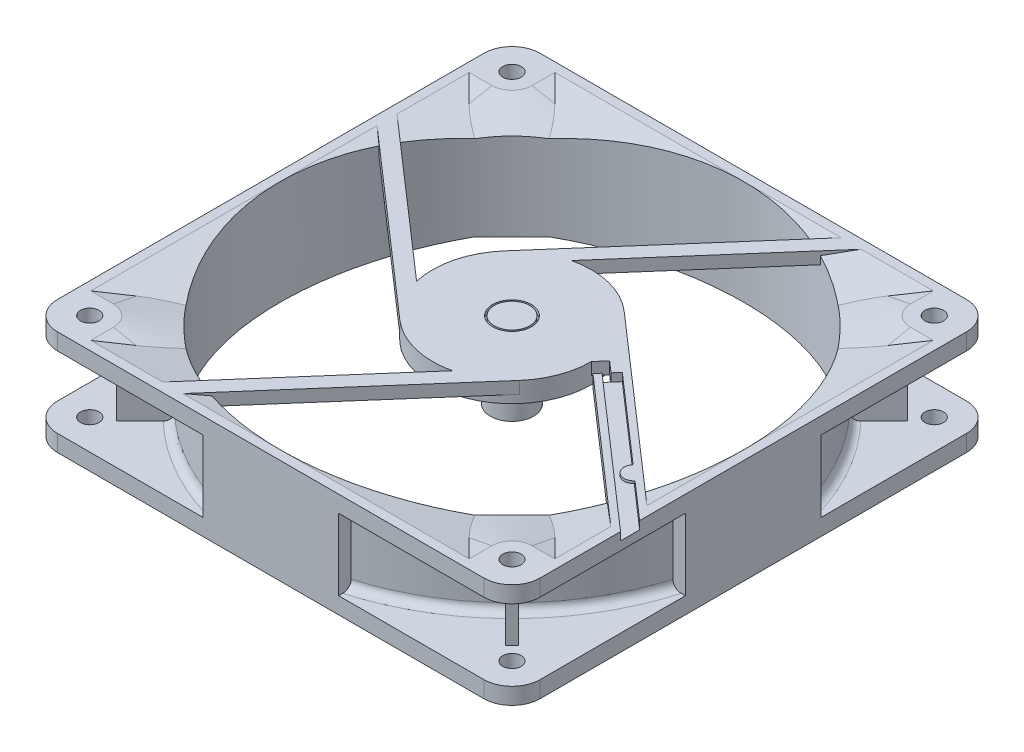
SolidWorks part; units mm, degrees
ref_plane "Front Plane" through (0, 0, 0) normal (0, 0, 1) x (1, 0, 0)
ref_plane "Top Plane" through (0, 0, 0) normal (0, 1, 0) x (1, 0, 0)
ref_plane "Right Plane" through (0, 0, 0) normal (1, 0, 0) x (0, 0, -1)
sketch "Sketch1" plane through (0, 0, 0) normal (0, 1, 0) x (1, 0, 0)
  line L1 (-60, 60) -> (60, 60)
  line L2 (-60, 60) -> (-60, -60)
  line L3 (-60, -60) -> (60, -60)
  line L4 (60, 60) -> (60, -60)
  line L5 (-60, 60) -> (-52.5, 52.5) construction
  line L6 (-60, -60) -> (-52.5, -52.5) construction
  line L7 (52.5, 52.5) -> (60, 60) construction
  line L8 (52.5, -52.5) -> (60, -60) construction
  line L10 (-50.8737, -50.8737) -> (50.8737, 50.8737) construction
  line L11 (-50.8737, 50.8737) -> (50.8737, -50.8737) construction
  line L12 (-50.8737, -50.8737) -> (50.8737, 50.8737) construction
  line L16 (-50.8737, 50.8737) -> (50.8737, -50.8737) construction
  circle A0 centre (-52.5, 52.5) radius 2.3
  circle A1 centre (52.5, 52.5) radius 2.3
  circle A2 centre (52.5, -52.5) radius 2.3
  circle A3 centre (-52.5, -52.5) radius 2.3
  point P0 (0, 0)
  point P6 (0, 0)
  dimension "D5" = 4.6
  dimension "D1" = 120
  dimension "D2" = 120
  dimension "D3" = 105
  dimension "D4" = 105
extrude "Boss-Extrude1" add sketch "Sketch1" along normal blind 26
sketch "Sketch2" plane through (0, 26, 0) normal (0, 1, 0) x (1, 0, 0)
  circle A0 centre (0, 0) radius 57.7
extrude "Cut-Extrude1" cut sketch "Sketch2" against normal blind 30
sketch "Sketch4" plane through (0, 0, 0) normal (1, 0, 0) x (0, 0, -1)
  line L0 (0, 0) -> (0, 42.0699) construction
  line L1 (-59.3503, 19.877) -> (-59.3503, 6.123)
  line L2 (-61.3503, 21.877) -> (-105.7428, 21.877)
  line L3 (-105.7428, 21.877) -> (-105.7428, 4.123)
  line L5 (-61.3503, 4.123) -> (-105.7428, 4.123)
  arc A0 (-59.3503, 6.123) -> (-61.3503, 4.123) centre (-61.3503, 6.123) cw
  arc A1 (-59.3503, 19.877) -> (-61.3503, 21.877) centre (-61.3503, 19.877) ccw
  point P11 (-52.0048, 13)
  point P14 (-105.7428, 13)
  dimension "D1" = 2
revolve "Cut-Revolve2" cut sketch "Sketch4" angle 360 about L0
sketch "Sketch5" plane through (0, 0, 0) normal (1, 0, 0) x (0, 0, -1)
  line L0 (-60, 0) -> (60, 0) construction
  line L1 (-16.8871, 26) -> (16.8871, 26)
  line L2 (-16.8871, 26) -> (-16.8871, 0)
  line L3 (-16.8871, 0) -> (16.8871, 0)
  line L4 (16.8871, 26) -> (16.8871, 0)
  line L5 (-16.8871, 26) -> (16.8871, 0) construction
  line L6 (-16.8871, 0) -> (16.8871, 26) construction
  point P0 (0, 13)
  dimension "D1" = 33.7741
extrude "Boss-Extrude2" add sketch "Sketch5" along normal up to surface and the other way up to surface
sketch "Sketch6" plane through (0, 0, 0) normal (0, 0, 1) x (1, 0, 0)
  line L0 (60, 26) -> (-60, 26) construction
  line L1 (16.894, 0) -> (-16.894, 0)
  line L2 (16.894, 0) -> (16.894, 26)
  line L3 (16.894, 26) -> (-16.894, 26)
  line L4 (-16.894, 0) -> (-16.894, 26)
  line L5 (16.894, 0) -> (-16.894, 26) construction
  line L6 (16.894, 26) -> (-16.894, 0) construction
  point P0 (0, 13)
extrude "Boss-Extrude3" add sketch "Sketch6" along normal up to surface and the other way up to surface
sketch "Sketch7" plane through (0, 26, 0) normal (0, 1, 0) x (1, 0, 0)
  circle A0 centre (0, 0) radius 57.7
extrude "Cut-Extrude2" cut sketch "Sketch7" against normal blind 50
fillet "Fillet1" radius 7 8 edges at (-60, 2.0615, 60) (-60, 23.9385, 60) (60, 23.9385, 60) (60, 2.0615, 60) (-60, 2.0615, -60) (-60, 23.9385, -60) (60, 2.0615, -60) (60, 23.9385, -60)
sketch "Sketch8" plane through (0, 26, 0) normal (0, 1, 0) x (1, 0, 0)
  line L0 (52.5, 52.5) -> (40.2381, 40.2381) construction
  line L1 (48.364, 50.0322) -> (50.0322, 48.364)
  line L2 (50.0322, 48.364) -> (41.0722, 39.404)
  line L3 (48.364, 50.0322) -> (39.404, 41.0722)
  line L4 (50.0322, -48.364) -> (41.0722, -39.404)
  line L5 (48.364, -50.0322) -> (39.404, -41.0722)
  line L6 (50.0322, -48.364) -> (48.364, -50.0322)
  line L7 (-48.364, -50.0322) -> (-39.404, -41.0722)
  line L8 (-50.0322, -48.364) -> (-41.0722, -39.404)
  line L9 (-48.364, -50.0322) -> (-50.0322, -48.364)
  line L10 (-50.0322, 48.364) -> (-41.0722, 39.404)
  line L11 (-48.364, 50.0322) -> (-39.404, 41.0722)
  line L12 (-50.0322, 48.364) -> (-48.364, 50.0322)
  line L13 (-39.404, 41.0722) -> (-41.0722, 39.404)
  line L14 (39.404, 41.0722) -> (41.0722, 39.404)
  line L15 (41.0722, -39.404) -> (39.404, -41.0722)
  line L16 (-41.0722, -39.404) -> (-39.404, -41.0722)
  point P7 (49.1981, 49.1981)
  point P23 (0, 0)
  dimension "D1" = 4
extrude "Boss-Extrude4" add sketch "Sketch8" against normal up to surface (26 mm away)
sketch "Sketch9" plane through (0, 26, 0) normal (0, 1, 0) x (1, 0, 0)
  circle A0 centre (0, 0) radius 57.7
extrude "Cut-Extrude3" cut sketch "Sketch9" against normal blind 50
ref_plane "Plane1" through (0, 13, 0) normal (0, 1, 0) x (1, 0, 0)
sketch "Sketch10" plane through (0, 26, 0) normal (0, 1, 0) x (1, 0, 0)
  line L1 (-52.0503, 47.0503) -> (-57.7041, 47.0503)
  line L2 (-47.0503, 52.0503) -> (-47.0503, 57.7041)
  line L6 (-47.0503, -57.7041) -> (47.0503, -57.7041)
  line L7 (-57.7041, -47.0503) -> (-57.7041, 47.0503)
  line L8 (-47.0503, 57.7041) -> (47.0503, 57.7041)
  line L9 (57.7041, -47.0503) -> (57.7041, 47.0503)
  line L10 (-48.5147, -48.5147) -> (57.7041, 57.7041) construction
  line L11 (47.0503, -47.0503) -> (-47.0503, 47.0503) construction
  line L12 (47.0503, 47.0503) -> (-47.0503, -47.0503) construction
  line L14 (52.0503, 47.0503) -> (57.7041, 47.0503)
  line L15 (47.0503, 52.0503) -> (47.0503, 57.7041)
  line L18 (47.0503, -52.0503) -> (47.0503, -57.7041)
  line L19 (52.0503, -47.0503) -> (57.7041, -47.0503)
  line L22 (-52.0503, -47.0503) -> (-57.7041, -47.0503)
  line L23 (-47.0503, -52.0503) -> (-47.0503, -57.7041)
  line L24 (-48.5147, 48.5147) -> (48.5147, -48.5147) construction
  arc A1 (47.0503, -52.0503) -> (52.0503, -47.0503) centre (52.0503, -52.0503) cw
  arc A2 (52.0503, 47.0503) -> (47.0503, 52.0503) centre (52.0503, 52.0503) cw
  arc A3 (-52.0503, 47.0503) -> (-47.0503, 52.0503) centre (-52.0503, 52.0503) ccw
  arc A4 (-52.0503, -47.0503) -> (-47.0503, -52.0503) centre (-52.0503, -52.0503) cw
  point P0 (-52.5, 52.5)
  point P9 (0, 0)
  point P32 (0, 0)
  point P36 (0, 0)
  dimension "D2" = 5
  dimension "D1" = 4
extrude "Cut-Extrude4" cut sketch "Sketch10" against normal blind 3 draft 79
mirror "Mirror1" about plane through (0, 13, 0) normal (0, 1, 0) of "Cut-Extrude4"
sketch "Sketch11" plane through (0, 26, 0) normal (0, 1, 0) x (1, 0, 0)
  circle A0 centre (0, 0) radius 19.77
extrude "Boss-Extrude5" add sketch "Sketch11" against normal blind 5 separate body
sketch "Sketch12" plane through (0, 26, 0) normal (0, 1, 0) x (1, 0, 0)
  line L0 (24.1445, 57.7041) -> (-14.8911, 13.0041) construction
  line L1 (47.0503, 57.7041) -> (-47.0503, 57.7041) construction
  line L2 (-14.8911, 13.0041) -> (-12.0764, 10.5461) construction
  line L3 (-14.8911, 13.0041) -> (24.1445, 57.7041)
  line L4 (24.1445, 57.7041) -> (29.1057, 57.7041)
  line L5 (29.1057, 57.7041) -> (-12.0764, 10.5461)
  line L6 (-14.8911, 13.0041) -> (-12.0764, 10.5461)
  line L7 (13.0041, 14.8911) -> (57.7041, -24.1445)
  line L8 (57.7041, -29.1057) -> (10.5461, 12.0764)
  line L9 (57.7041, -24.1445) -> (57.7041, -29.1057)
  line L10 (13.0041, 14.8911) -> (10.5461, 12.0764)
  line L11 (14.8911, -13.0041) -> (-24.1445, -57.7041)
  line L12 (-29.1057, -57.7041) -> (12.0764, -10.5461)
  line L13 (-24.1445, -57.7041) -> (-29.1057, -57.7041)
  line L14 (14.8911, -13.0041) -> (12.0764, -10.5461)
  line L15 (-13.0041, -14.8911) -> (-57.7041, 24.1445)
  line L16 (-57.7041, 29.1057) -> (-10.5461, -12.0764)
  line L17 (-57.7041, 24.1445) -> (-57.7041, 29.1057)
  line L18 (-13.0041, -14.8911) -> (-10.5461, -12.0764)
  circle A0 centre (0, 0) radius 19.77 construction
  point P23 (0, 0)
  dimension "D1" = 4
extrude "Boss-Extrude6" add sketch "Sketch12" against normal blind 3
sketch "Sketch13" plane through (0, 26, 0) normal (0, 1, 0) x (1, 0, 0)
  circle A0 centre (0, 0) radius 4.3649
extrude "Cut-Extrude5" cut sketch "Sketch13" against normal blind 10
sketch "Sketch14" plane through (0, 26, 0) normal (0, 1, 0) x (1, 0, 0)
  circle A0 centre (0, 0) radius 4.3649
extrude "Extrude-Thin1" add sketch "Sketch14" against normal blind 19 thin
sketch "Sketch15" plane through (0, 7, 0) normal (0, -1, 0) x (1, 0, 0)
  circle A0 centre (0, 0) radius 4.3649
extrude "Boss-Extrude7" add sketch "Sketch15" against normal blind 14
sketch "Sketch16" plane through (0, 21, 0) normal (0, 1, 0) x (1, 0, 0)
  circle A0 centre (0, 0) radius 1.4328
  dimension "D1" = 2.8657
extrude "Cut-Extrude6" cut sketch "Sketch16" against normal blind 34
sketch "Sketch17" plane through (0, 26, 0) normal (0, 1, 0) x (1, 0, 0)
  line L0 (19.77, 0) -> (57.7041, -33.1271)
  line L1 (57.7041, -47.0503) -> (57.7041, -29.1057) construction
  line L2 (57.7041, -24.1445) -> (13.0041, 14.8911) construction
  line L9 (14.8911, -13.0041) -> (-24.1445, -57.7041)
  line L10 (57.7041, -29.1057) -> (19.2585, 4.4681)
  line L11 (57.7041, -47.0503) -> (57.7041, -29.1057)
  line L12 (52.0503, -47.0503) -> (57.7041, -47.0503)
  line L13 (47.0503, -57.7041) -> (47.0503, -52.0503)
  line L14 (-24.1445, -57.7041) -> (47.0503, -57.7041)
  line L16 (57.7041, -29.1057) -> (19.2585, 4.4681)
  line L17 (57.7041, -33.1271) -> (57.7041, -29.1057)
  arc A0 (14.8911, -13.0041) -> (19.2585, 4.4681) centre (0, 0) ccw construction
  arc A3 (14.8911, -13.0041) -> (19.2585, 4.4681) centre (0, 0) ccw
  arc A4 (52.0503, -47.0503) -> (47.0503, -52.0503) centre (52.0503, -52.0503) ccw
  arc A5 (19.77, 0) -> (19.2585, 4.4681) centre (0, 0) ccw
  dimension "D1" = 0
extrude "Boss-Extrude8" add sketch "Sketch17" against normal up to surface (3 mm away)
sketch "Sketch18" plane through (0, 26, 0) normal (0, 1, 0) x (1, 0, 0)
  line L0 (19.77, 0) -> (21.8739, 2.4092)
  line L1 (21.8739, 2.4092) -> (24.6327, 0)
  line L2 (24.6327, 0) -> (21.332, -3.7797)
  line L3 (21.332, -3.7797) -> (19.77, 0)
extrude "Cut-Extrude7" cut sketch "Sketch18" against normal blind 3
sketch "Sketch19" plane through (0, 26, 0) normal (0, 1, 0) x (1, 0, 0)
  line L0 (23.5807, -1.2046) -> (61.5209, -34.337)
  line L1 (22.5288, -2.4092) -> (24.6327, 0) construction
  line L2 (61.5209, -34.337) -> (61.5209, -29.5833)
  line L3 (61.5209, -29.5833) -> (25.936, 1.4924)
  line L4 (25.936, 1.4924) -> (23.5807, -1.2046)
extrude "Cut-Extrude8" cut sketch "Sketch19" against normal blind 2 contours L3 L4 L0 L2
sketch "Sketch20" plane through (0, 26, 0) normal (0, 1, 0) x (1, 0, 0)
  line L0 (60, -28.255) -> (25.936, 1.4924) construction
  line L1 (60, -28.255) -> (25.936, 1.4924) construction
  line L2 (47.1637, -17.0454) -> (50.8722, -20.2839)
  line L3 (50.8722, -20.2839) -> (50.8014, -20.1933)
  arc A0 (47.1637, -17.0454) -> (50.8722, -20.2839) centre (49.018, -18.6646) ccw
extrude "Boss-Extrude9" add sketch "Sketch20" against normal blind 0.6 contours L2 A0
sketch "Sketch21" plane through (0, 21, 0) normal (0, 1, 0) x (1, 0, 0)
  circle A0 centre (0, 0) radius 4.3649
extrude "Cut-Extrude9" cut sketch "Sketch21" against normal blind 3
sketch "Sketch22" plane through (0, 26, 0) normal (0, 1, 0) x (1, 0, 0)
  circle A0 centre (0, 0) radius 4.3649
extrude "Boss-Extrude10" add sketch "Sketch22" against normal blind 1 separate body
sketch "Sketch23" plane through (0, 26, 0) normal (0, 1, 0) x (1, 0, 0)
  circle A0 centre (0, 0) radius 4.8169
extrude "Cut-Extrude-Thin1" cut sketch "Sketch23" against normal blind 1 thin
